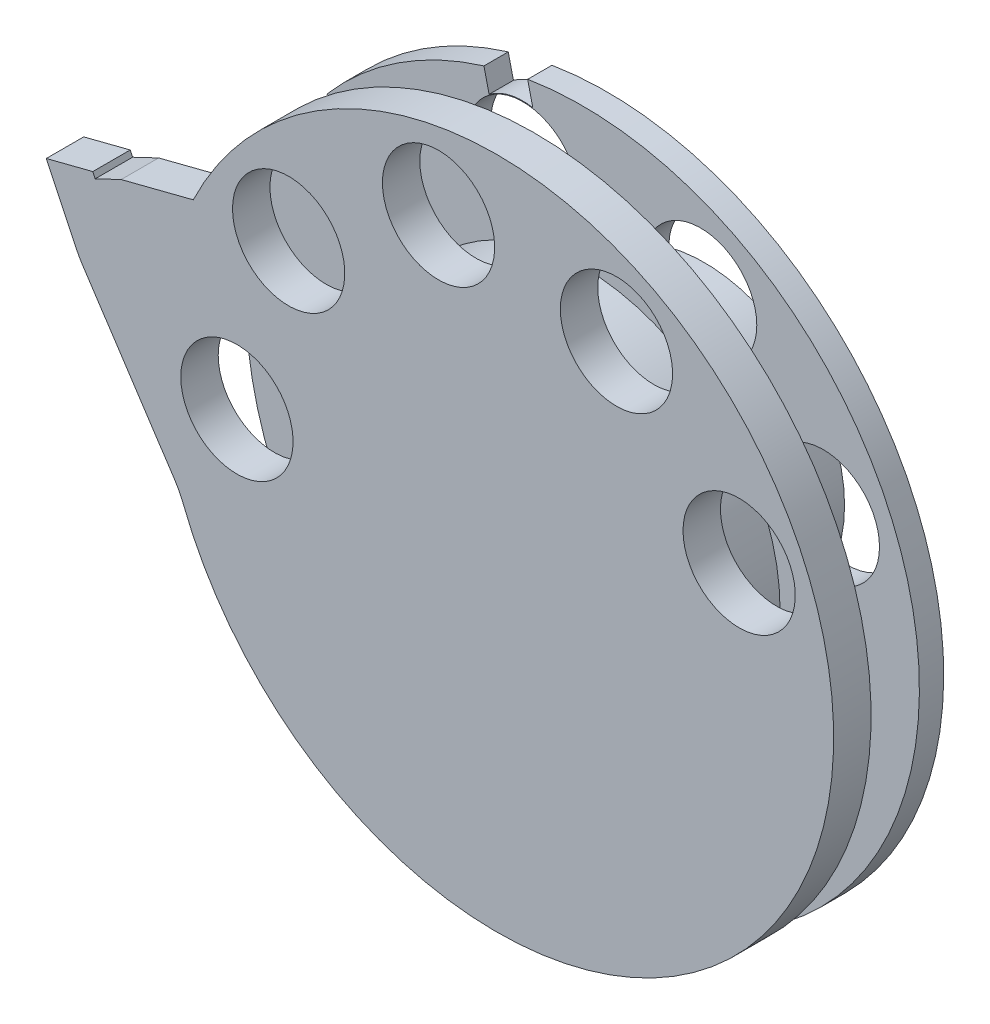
SolidWorks part; units mm, degrees
ref_plane "正面" through (0, 0, 0) normal (0, 0, 1) x (1, 0, 0)
ref_plane "平面" through (0, 0, 0) normal (0, 1, 0) x (1, 0, 0)
ref_plane "右側面" through (0, 0, 0) normal (1, 0, 0) x (0, 0, -1)
sketch "ｽｹｯﾁ1" plane through (0, 0, 0) normal (0, 0, 1) x (-1, 0, 0)
  circle A0 centre (13.9779, 0.7861) radius 3
  circle A1 centre (11.213, -8.3826) radius 3
  circle A2 centre (3.2014, -13.5915) radius 3
  circle A3 centre (-6.3082, -12.4983) radius 3
  arc A4 (6.5195, -16.7778) -> (2.2547, 17.8582) centre (0, 0) ccw
  arc A5 (2.2547, 17.8582) -> (6.5195, -16.7778) centre (0, 0) ccw
  circle A6 centre (-12.8661, -5.5194) radius 3
  arc A12 (0.2016, -13.629) -> (6.2012, -13.629) centre (3.2014, -13.5915) ccw
  arc A13 (-8.6063, -10.5699) -> (-4.01, -14.4266) centre (-6.3082, -12.4983) ccw
  arc A14 (-13.387, -2.565) -> (-12.3451, -8.4739) centre (-12.8661, -5.5194) ccw
  arc A17 (13.5111, -6.4543) -> (10.1442, -5.5795) centre (11.213, -8.3826) ccw
  arc A18 (11.5376, -0.9588) -> (13.457, -2.1683) centre (13.9779, 0.7861) ccw
  circle A20 centre (0, 0) radius 9.25
  dimension "D1" = 18
  dimension "D2" = 18.5
  dimension "D3" = 6
extrude "ﾎﾞｽ - 押し出し1" add sketch "ｽｹｯﾁ1" along normal blind 1.3 contours A4 A5 A20 A6 A0 A1 A2 A3
sketch "ｽｹｯﾁ2" plane through (0, 0, 1.3) normal (0, 0, 1) x (1, 0, 0)
  circle A0 centre (0, 0) radius 10.55
  circle A1 centre (0, 0) radius 9.25
  circle A2 centre (0, 0) radius 9.25 construction
  dimension "D1" = 1.3
extrude "ﾎﾞｽ - 押し出し2" add sketch "ｽｹｯﾁ2" along normal blind 2.5
sketch "ｽｹｯﾁ3" plane through (0, 0, 3.8) normal (0, 0, 1) x (1, 0, 0)
  line L19 (-21.5522, 6.0946) -> (-20.1632, 6.7556)
  line L20 (-21.6815, 6.3662) -> (-21.5522, 6.0946)
  line L21 (-24.1667, 5.7288) -> (-21.6815, 6.3662)
  line L22 (-22.5642, 2.3613) -> (-24.1667, 5.7288)
  line L23 (-17.3206, -5.6861) -> (-22.2249, 1.7593)
  line L24 (-20.1632, 6.7556) -> (-16.3113, 7.7434)
  circle A8 centre (0, 0) radius 10.55 construction
  arc A13 (-22.2249, 1.7593) -> (-22.5642, 2.3613) centre (-18.0493, 4.5097) cw
  arc A14 (-17.3206, -5.6861) -> (-16.841, -6.6118) centre (-21.4961, -8.4366) cw
  arc A15 (7.9749, -16.1388) -> (-16.841, -6.6118) centre (-0.0825, -0.0428) cw
  arc A16 (-16.3113, 7.7434) -> (7.9749, -16.1388) centre (-0.0825, -0.0428) cw
  dimension "D1" = 5
  dimension "D2" = 18
  dimension "D3" = 7.9749
  dimension "D4" = 0.0825
  dimension "D5" = 16.3113
  dimension "D6" = 16.841
  dimension "D7" = 17.3206
  dimension "D8" = 18.0493
  dimension "D9" = 20.1632
  dimension "D10" = 21.5522
  dimension "D11" = 21.6815
  dimension "D12" = 22.5642
  dimension "D13" = 1.7593
extrude "ﾎﾞｽ - 押し出し3" add sketch "ｽｹｯﾁ3" along normal blind 2
sketch "ｽｹｯﾁ4" plane through (0, 0, 3.8) normal (0, 0, -1) x (-1, 0, 0)
  circle A0 centre (-12.8661, 5.5194) radius 3 construction
  circle A1 centre (0, 0) radius 9.25 construction
  circle A2 centre (-6.3082, 12.4983) radius 3 construction
  circle A3 centre (3.2014, 13.5915) radius 3 construction
  circle A4 centre (11.213, 8.3826) radius 3 construction
  circle A5 centre (13.9779, -0.7861) radius 3 construction
  circle A6 centre (-12.8661, 5.5194) radius 3
  circle A7 centre (0, 0) radius 9.25
  circle A8 centre (-6.3082, 12.4983) radius 3
  circle A9 centre (3.2014, 13.5915) radius 3
  circle A10 centre (11.213, 8.3826) radius 3
  circle A11 centre (13.9779, -0.7861) radius 3
extrude "ｶｯﾄ - 押し出し1" cut sketch "ｽｹｯﾁ4" against normal blind 2.5 contours A11 | A10 | A9 | A8 | A6 | A7
sketch "ｽｹｯﾁ5" plane through (0, 0, 3.8) normal (0, 0, -1) x (-1, 0, 0)
  circle A0 centre (0, 0) radius 7.5
  dimension "D1" = 15
fillet "ﾌｨﾚｯﾄ1" radius 1 2 edges at (9.25, 0, 0) (9.25, 0, 3.8)
sketch "ｽｹｯﾁ6" plane through (0, 0, 0) normal (0, 0, -1) x (-1, 0, 0)
  line L0 (13.9779, -0.7861) -> (17.9716, -1.0107)
  line L1 (13.9105, -1.9842) -> (17.9042, -2.2088)
  line L2 (14.0453, 0.412) -> (18.039, 0.1874)
  line L3 (11.9315, 7.4215) -> (15.1352, 9.8166)
  line L4 (10.4945, 9.3437) -> (13.6982, 11.7388)
  line L5 (4.3696, 13.3546) -> (5.2843, 17.2487)
  line L6 (2.0332, 13.9035) -> (2.9479, 17.7975)
  line L7 (-5.2369, 13.039) -> (-7.0392, 16.6099)
  line L8 (-7.3794, 11.9576) -> (-9.1818, 15.5285)
  line L9 (-12.393, 6.6222) -> (-16.069, 8.1992)
  line L10 (-13.3392, 4.4166) -> (-17.0152, 5.9936)
  circle A0 centre (13.9779, -0.7861) radius 3 construction
  circle A1 centre (13.9779, -0.7861) radius 3
  circle A2 centre (0, 0) radius 18 construction
  circle A3 centre (0, 0) radius 18
  circle A4 centre (11.213, 8.3826) radius 3
  circle A5 centre (3.2014, 13.629) radius 3
  circle A6 centre (-6.3082, 12.4983) radius 3
  circle A7 centre (-12.8661, 5.5194) radius 3
  dimension "D1" = 1.2
  dimension "D2" = 1.2
  dimension "D3" = 5
extrude "ｶｯﾄ - 押し出し3" cut sketch "ｽｹｯﾁ6" against normal blind 2.5 contours L1 L0 M4 M8 | L2 L0 M4 M8 | L4 L3 M5 M8 | A5 L5 L6 M8 | A7
extrude "ﾎﾞｽ - 押し出し4" add sketch "ｽｹｯﾁ5" along normal blind 9 contours A0
